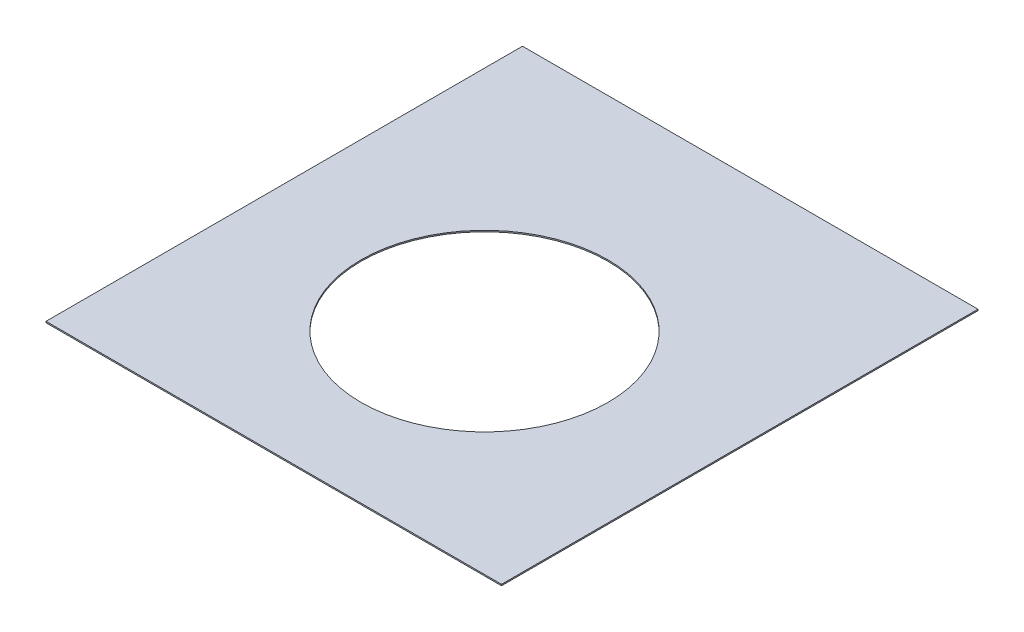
SolidWorks part; units mm, degrees
ref_plane "FRONT" through (0, 0, 0) normal (0, 0, 1) x (1, 0, 0)
ref_plane "TOP" through (0, 0, 0) normal (0, 1, 0) x (1, 0, 0)
ref_plane "RIGHT" through (0, 0, 0) normal (1, 0, 0) x (0, 0, -1)
sketch "Sketch1" plane through (0, 0, 0) normal (0, 1, 0) x (1, 0, 0)
  line L1 (-828.675, 866.775) -> (828.675, 866.775)
  line L2 (-828.675, 866.775) -> (-828.675, -866.775)
  line L3 (-828.675, -866.775) -> (828.675, -866.775)
  line L4 (828.675, 866.775) -> (828.675, -866.775)
  line L5 (-828.675, 866.775) -> (828.675, -866.775) construction
  line L6 (-828.675, -866.775) -> (828.675, 866.775) construction
  point P0 (0, 0)
  dimension "D1" = 1733.55
  dimension "D2" = 1657.35
sheet metal parameters "Sheet-Metal1" thickness 4.7625 parameters "D1"=4.7625
base flange "Base-Flange1" sketch "Sketch1" thickness 4.7625 reverse thickness direction no parameters "D1"=4.7625
sketch "Sketch3" plane through (0, 0, 0) normal (0, 1, 0) x (1, 0, 0)
  line L0 (-828.675, -866.775) -> (828.675, -866.775) construction
  line L1 (-828.675, 866.775) -> (-828.675, -866.775) construction
  circle A0 centre (0, -100.0125) radius 449.2625
  dimension "D1" = 898.525
  dimension "D2" = 766.7625
  dimension "D3" = 828.675
extrude "Cut-Extrude1" cut sketch "Sketch3" against normal through all
flat pattern "Flat-Pattern1"
sketch "Bend-Lines1" plane through (0, 0, 0) normal (0, 1, 0) x (-1, 0, 0)
sketch3d "Bounding-Box1" [suppressed]
  line L0 (1657.35, -1733.55, 0) -> (1657.35, 0, 0) construction
  line L1 (0, -1733.55, 0) -> (0, 0, 0) construction
  line L2 (1657.35, -1733.55, 0) -> (0, -1733.55, 0) construction
  line L3 (1657.35, 0, 0) -> (0, 0, 0) construction
